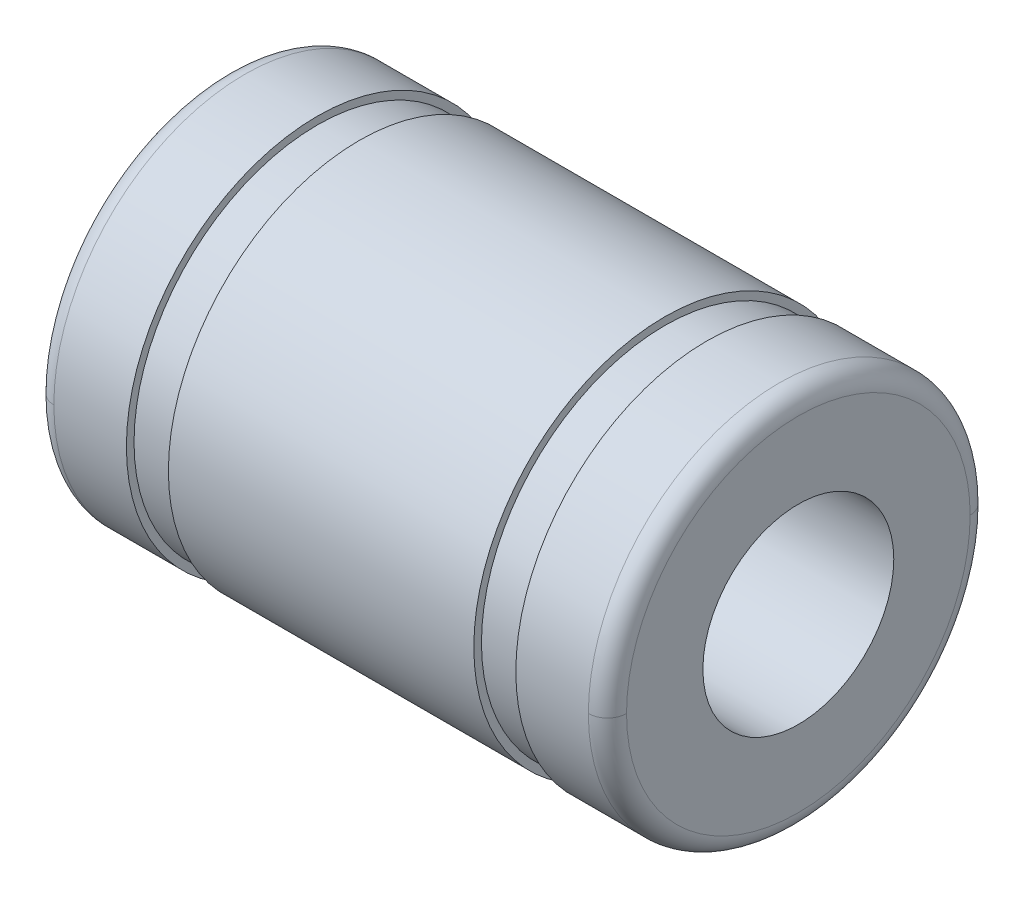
SolidWorks part; units mm, degrees
other "Solid2"
ref_plane "Front Plane" through (0, 0, 0) normal (0, 0, 1) x (1, 0, 0)
ref_plane "Top Plane" through (0, 0, 0) normal (0, 1, 0) x (1, 0, 0)
ref_plane "Right Plane" through (0, 0, 0) normal (1, 0, 0) x (0, 0, -1)
imported_body "2.7003 LM5UU.stp<1>"
fillet "Fillet1" radius 0.5
